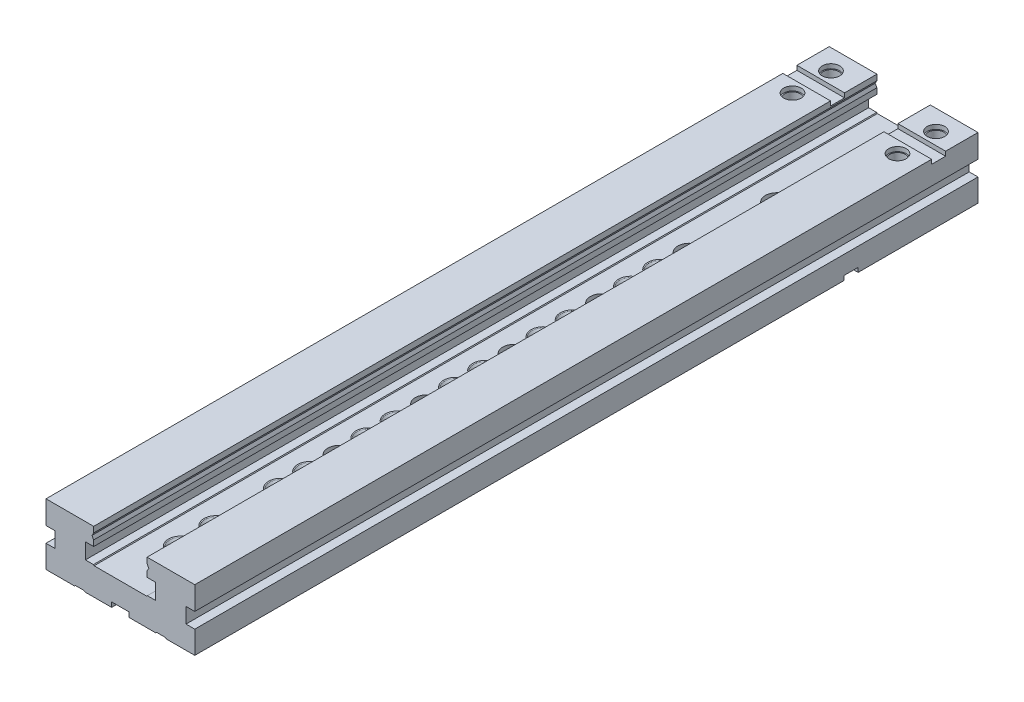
SolidWorks part; units mm, degrees
ref_plane "Front Plane" through (0, 0, 0) normal (0, 0, 1) x (1, 0, 0)
ref_plane "Top Plane" through (0, 0, 0) normal (0, 1, 0) x (1, 0, 0)
ref_plane "Right Plane" through (0, 0, 0) normal (1, 0, 0) x (0, 0, -1)
imported_body "Imported1"
sketch "Sketch1" plane through (0, -3.8, 0) normal (0, 1, 0) x (1, 0, 0)
  circle A0 centre (0, 150) radius 13
  circle A1 centre (0, 250) radius 13
  circle A2 centre (0, 350) radius 13
  circle A3 centre (0, 450) radius 13
  circle A4 centre (0, 550) radius 13
  circle A5 centre (0, 650) radius 13
  circle A6 centre (0, 750) radius 13
extrude "Boss-Extrude1" add sketch "Sketch1" against normal up to surface (25.7 mm away)
hole_wizard "Hole1" positions "Sketch3" profile "Sketch2" legacy
sketch "Sketch3" plane through (0, -3.8, 0) normal (0, 1, 0) x (1, 0, 0)
  line L0 (-30.5, 895) -> (-85, 895) construction
  line L1 (-85, 858) -> (-85, 895) construction
  point P0 (0, 750)
  point P2 (0, 650)
  point P4 (0, 550)
  point P6 (0, 450)
  point P20 (0.0305, 350)
  point P22 (0.0305, 250)
  dimension "D1" = 145
  dimension "D2" = 100
  dimension "D3" = 100
  dimension "D4" = 100
  dimension "D5" = 100
  dimension "D6" = 100
  dimension "D8" = 85
sketch "Sketch2" plane through (0, -3.8, -750) normal (1, 0, 0) x (0, 0, 1)
  line L0 (0, 0) -> (0, 25.7)
  line L1 (0, 25.7) -> (8.5, 25.7)
  line L2 (8.5, 25.7) -> (8.5, 17)
  line L3 (8.5, 17) -> (13, 17)
  line L4 (13, 17) -> (13, 0)
  line L5 (13, 0) -> (0, 0)
  line L6 (0, 110) -> (0, -10) construction
  dimension "Diameter" = 17
  dimension "Depth" = 25.7
  dimension "C-Bore Diameter" = 26
  dimension "C-Bore Depth" = 17
